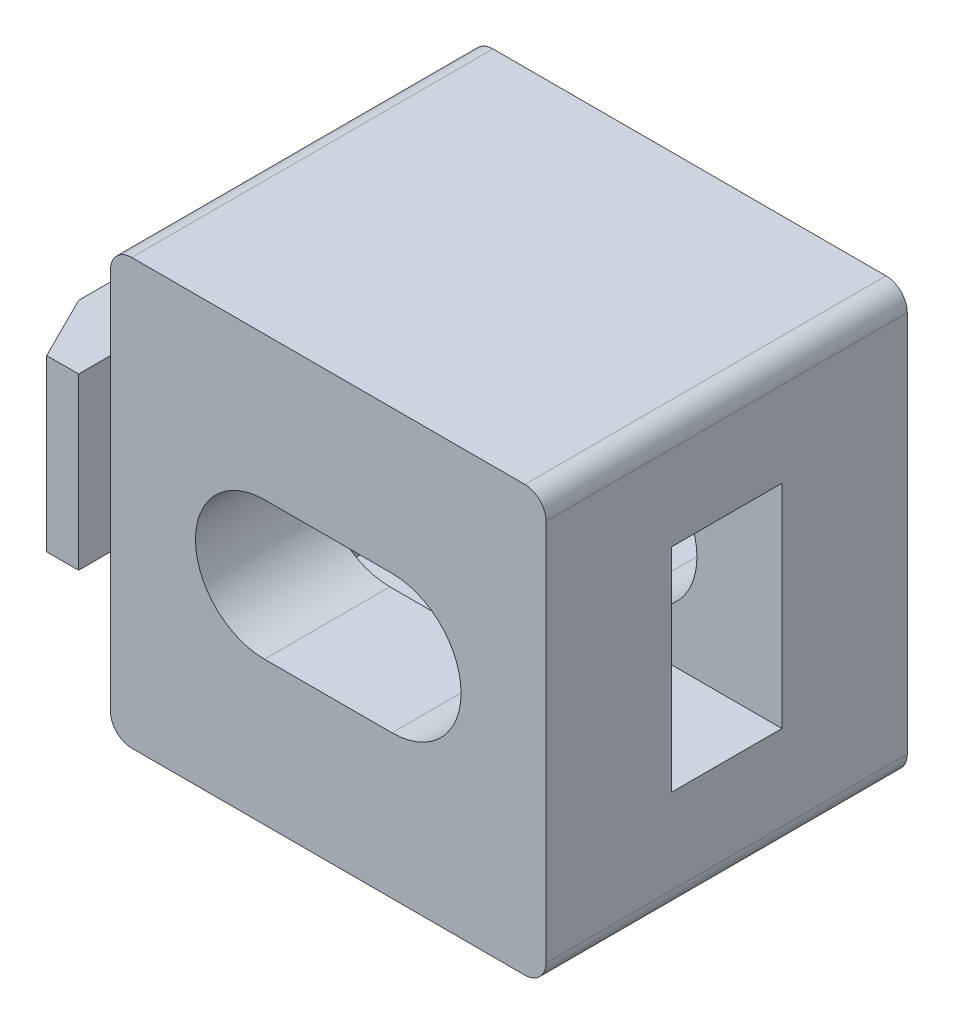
SolidWorks part; units mm, degrees
ref_plane "前视基准面" through (0, 0, 0) normal (0, 0, 1) x (1, 0, 0)
ref_plane "上视基准面" through (0, 0, 0) normal (0, 1, 0) x (1, 0, 0)
ref_plane "右视基准面" through (0, 0, 0) normal (1, 0, 0) x (0, 0, -1)
sketch "草图1" plane through (0, 0, 0) normal (0, 0, 1) x (1, 0, 0)
  line L0 (-3, 0) -> (3, 0) construction
  line L1 (-10.25, 10) -> (10.25, 10)
  line L2 (-10.25, 10) -> (-10.25, -10)
  line L3 (-10.25, -10) -> (10.25, -10)
  line L4 (10.25, 10) -> (10.25, -10)
  line L5 (-3, 3.25) -> (3, 3.25)
  line L6 (-3, -3.25) -> (3, -3.25)
  arc A0 (-3, 3.25) -> (-3, -3.25) centre (-3, 0) ccw
  arc A1 (3, -3.25) -> (3, 3.25) centre (3, 0) ccw
  point P7 (0, 0)
  dimension "D5" = 3.25
  dimension "D7" = 0
  dimension "D1" = 20.5
  dimension "D2" = 20
  dimension "D3" = 10
  dimension "D4" = 10.25
  dimension "D6" = 3
extrude "凸台-拉伸1" add sketch "草图1" along normal mid plane 17
sketch "草图2" plane through (10.25, 0, 0) normal (1, 0, 0) x (0, 0, -1)
  line L1 (-2.6, 5) -> (2.6, 5)
  line L2 (-2.6, 5) -> (-2.6, -5)
  line L3 (-2.6, -5) -> (2.6, -5)
  line L4 (2.6, 5) -> (2.6, -5)
  dimension "D1" = 10
  dimension "D2" = 5.2
  dimension "D3" = 2.6
  dimension "D4" = 5
extrude "切除-拉伸1" cut sketch "草图2" against normal blind 17
sketch "草图3" plane through (-10.25, 0, 0) normal (-1, 0, 0) x (0, 0, 1)
  line L0 (8.5, 10) -> (-8.5, 10) construction
  line L1 (-2.5, 4) -> (5.5, 4)
  line L2 (-2.5, 4) -> (-2.5, -4)
  line L3 (-2.5, -4) -> (5.5, -4)
  line L4 (5.5, 4) -> (5.5, -4)
  line L5 (-8.5, 10) -> (-8.5, -10) construction
  dimension "D1" = 8
  dimension "D2" = 8
  dimension "D3" = 6
  dimension "D4" = 6
extrude "凸台-拉伸2" add sketch "草图3" along normal blind 1.5
fillet "圆角1" radius 3 2 edges at (-11, -4, -2.5) (-11, 4, 5.5)
sketch "草图4" plane through (0, 0, 0) normal (0, 1, 0) x (1, 0, 0)
  line L0 (-11.75, 2.5) -> (-11.75, 5.5)
  line L1 (-11.75, 5.5) -> (-13.25, 5.5)
  line L2 (-13.25, 5.5) -> (-14.75, 2.5)
  line L3 (-14.75, 2.5) -> (-14.75, -1.5)
  line L4 (-14.75, -1.5) -> (-11.75, -1.5)
  line L6 (-11.75, -2.5) -> (-11.75, 2.5) construction
  line L7 (-10.25, -5.5) -> (-11.75, -5.5) construction
  line L8 (-11.75, 2.5) -> (-11.75, -1.5)
  dimension "D1" = 4
  dimension "D2" = 1.5
  dimension "D3" = 4
  dimension "D4" = 3
extrude "凸台-拉伸3" add sketch "草图4" along normal mid plane 8
mirror "镜向1" about plane through (-14.75, 4, 1.5) normal (0, 0, -1) of "凸台-拉伸3"
fillet "圆角2" radius 1 4 edges at (-10.25, -10, 0) (10.25, -10, 0) (10.25, 10, 0) (-10.25, 10, 0)
